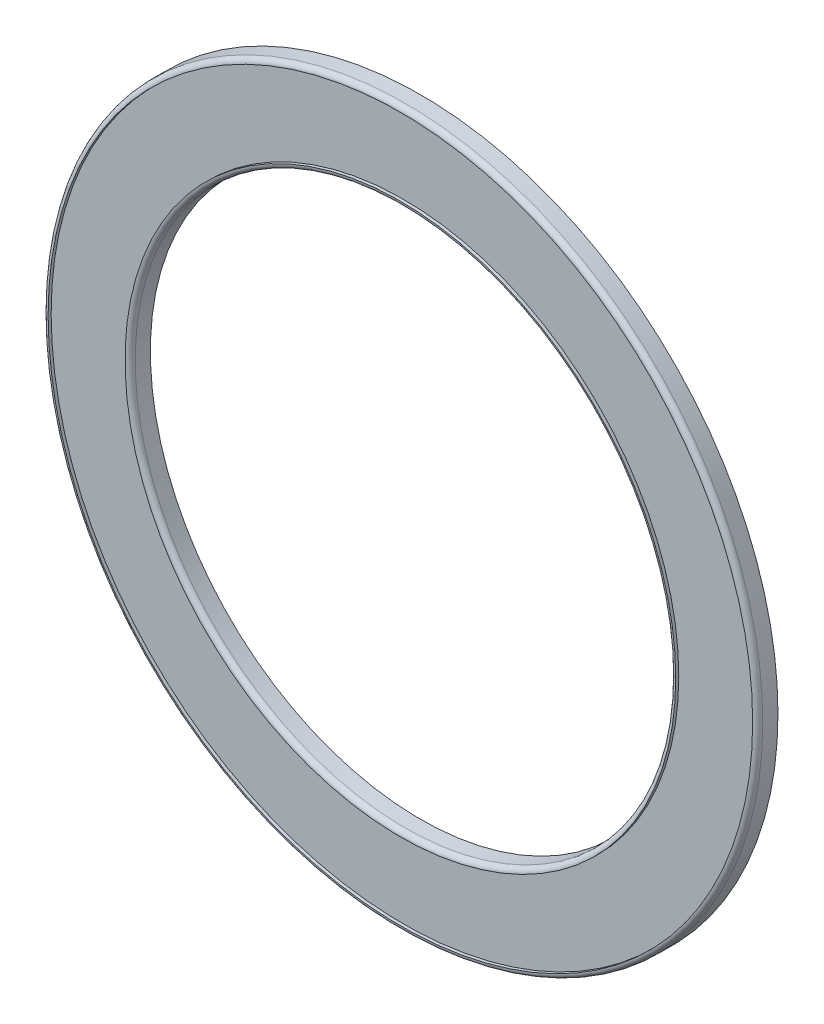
SolidWorks part; units mm, degrees
ref_plane "Спереди" through (0, 0, 0) normal (0, 0, 1) x (1, 0, 0)
ref_plane "Сверху" through (0, 0, 0) normal (0, 1, 0) x (1, 0, 0)
ref_plane "Справа" through (0, 0, 0) normal (1, 0, 0) x (0, 0, -1)
sketch "Эскиз1" plane through (0, 0, 0) normal (0, 0, 1) x (1, 0, 0)
  circle A0 centre (0, 0) radius 176.5
  circle A1 centre (0, 0) radius 133.5
  dimension "D1" = 353
  dimension "D2" = 267
extrude "Бобышка-Вытянуть1" add sketch "Эскиз1" along normal blind 10
sketch "Эскиз2" plane through (0, 0, 0) normal (0, 0, -1) x (-1, 0, 0)
  line L0 (0, 150.6115) -> (0, -213.8411) construction
  circle A0 centre (0, 0) radius 150.6115 construction
  circle A1 centre (0, 150.6115) radius 5
  circle A2 centre (-122.85, -87.1304) radius 5
  circle A3 centre (122.85, -87.1304) radius 5
  dimension "D1" = 301.223
  dimension "D2" = 10
  dimension "D3" = 245.7
extrude "Вырез-Вытянуть1" cut sketch "Эскиз2" against normal blind 5
sketch "Эскиз3" plane through (0, 0, 10) normal (0, 0, 1) x (1, 0, 0)
  circle A2 centre (0, 0) radius 174
  circle A3 centre (0, 0) radius 174
  circle A5 centre (0, 0) radius 136
  circle A6 centre (0, 0) radius 136
  dimension "D1" = 2.5
  dimension "D2" = 2.5
extrude "Вырез-Вытянуть2" cut sketch "Эскиз3" against normal blind 1.5
fillet "Скругление1" radius 2.5 2 edges at (133.5, 0, 10) (176.5, 0, 10)
